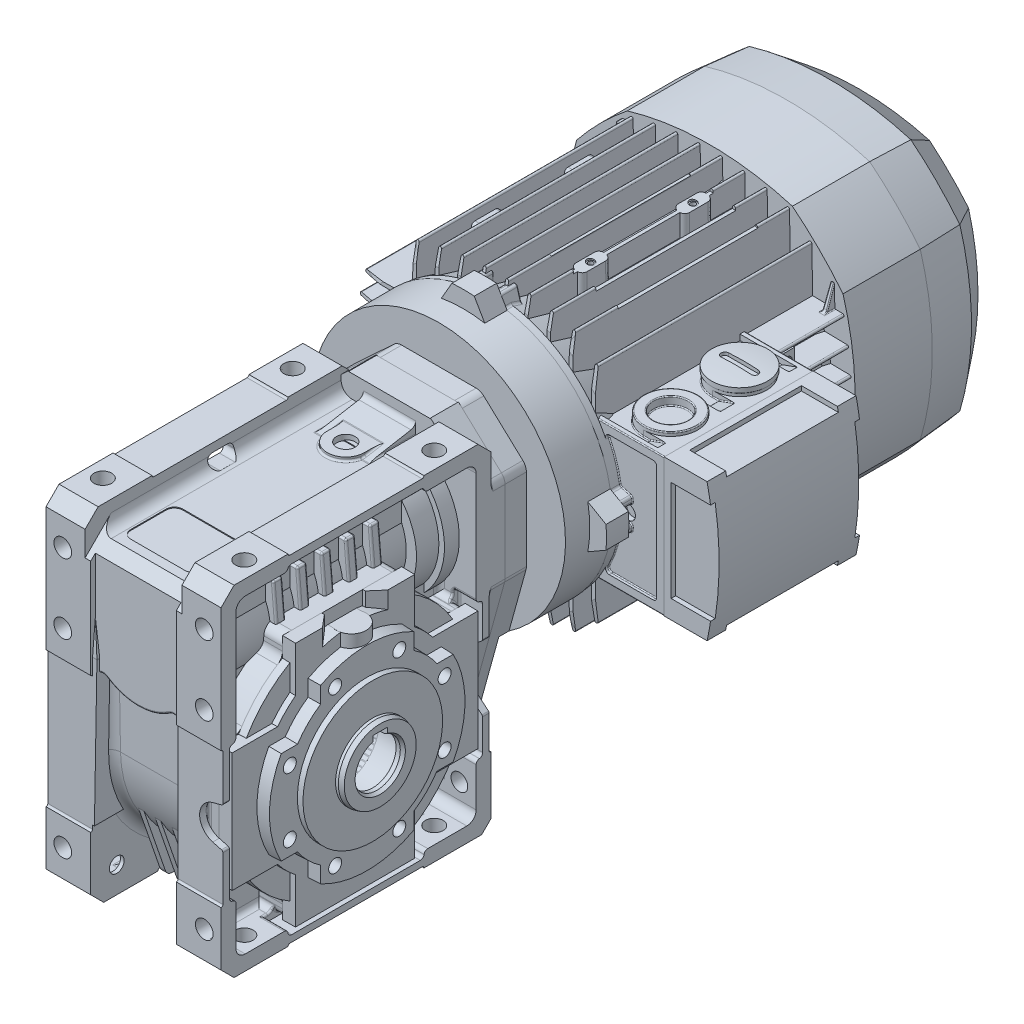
SolidWorks part; units mm, degrees
ref_plane "Plan de face" through (0, 0, 0) normal (0, 0, 1) x (1, 0, 0)
ref_plane "Plan de dessus" through (0, 0, 0) normal (0, 1, 0) x (1, 0, 0)
ref_plane "Plan de droite" through (0, 0, 0) normal (1, 0, 0) x (0, 0, -1)
imported_body "Importée1"
imported_body "Importée2"
imported_body "Importée3"
imported_body "Importée4"
imported_body "Importée5"
imported_body "Importée6"
imported_body "Importée7"
imported_body "Importée8"
imported_body "Importée9"
imported_body "Importée10"
imported_body "Importée12"
imported_body "Importée13"
sketch "Esquisse1" plane through (56, 0, 0) normal (1, 0, 0) x (0, 0, -1)
  circle A0 centre (-116.5, -62.17) radius 19.9846
extrude "Enlèv. mat.-Extru.1" cut sketch "Esquisse1" against normal blind 50
sketch "Esquisse2" plane through (-56, 0, 0) normal (-1, 0, 0) x (0, 0, 1)
  circle A0 centre (116.5, -62.17) radius 20.1058
extrude "Enlèv. mat.-Extru.2" cut sketch "Esquisse2" against normal blind 50
